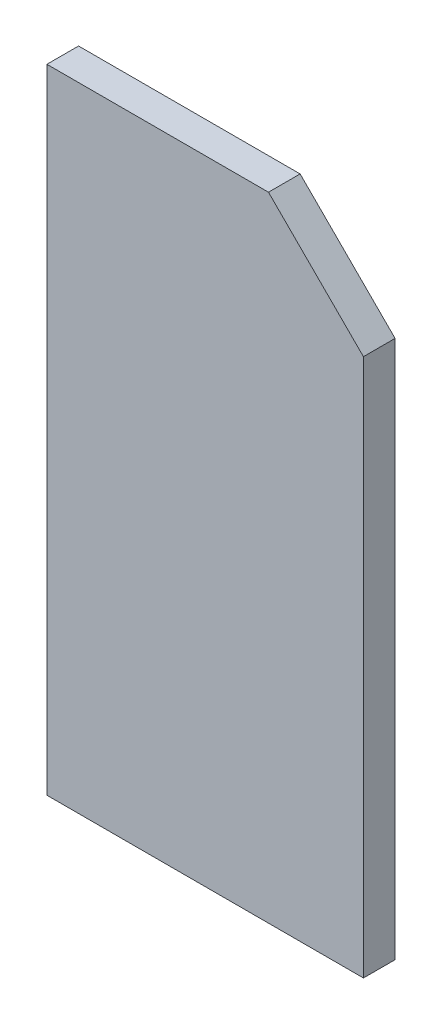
SolidWorks part; units mm, degrees
ref_plane "Front Plane" through (0, 0, 0) normal (0, 0, 1) x (1, 0, 0)
ref_plane "Top Plane" through (0, 0, 0) normal (0, 1, 0) x (1, 0, 0)
ref_plane "Right Plane" through (0, 0, 0) normal (1, 0, 0) x (0, 0, -1)
sketch "Sketch3" plane through (0, 0, 0) normal (0, 0, 1) x (1, 0, 0)
  line L0 (250, 500) -> (250, 0)
  line L1 (0, 0) -> (250, 0)
  line L2 (0, 0) -> (0, 500)
  line L3 (0, 500) -> (250, 500)
  dimension "D1" = 250
  dimension "D2" = 500
extrude "Boss-Extrude2" add sketch "Sketch3" along normal blind 25
sketch "Sketch4" plane through (0, 0, 25) normal (0, 0, 1) x (1, 0, 0)
  line L0 (175, 500) -> (250, 425)
  line L1 (250, 500) -> (0, 500) construction
  line L2 (250, 0) -> (250, 500) construction
  line L3 (250, 425) -> (250, 500)
  line L4 (250, 500) -> (175, 500)
  point P6 (250, 500)
  point P8 (163.2131, 500)
  point P9 (250, 398.5795)
  dimension "D1" = 75
  dimension "D2" = 75
extrude "Cut-Extrude1" cut sketch "Sketch4" against normal blind 25.4
